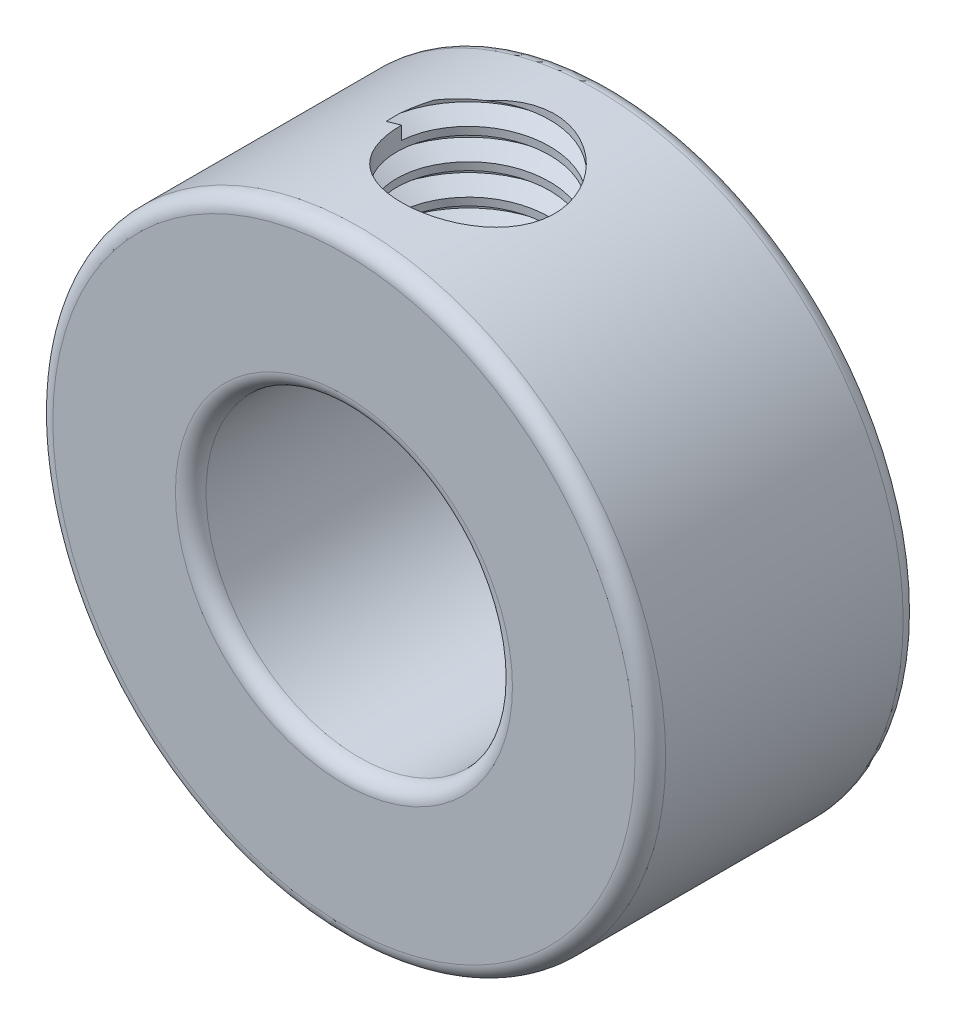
SolidWorks part; units mm, degrees
ref_plane "Front Plane" through (0, 0, 0) normal (0, 0, 1) x (1, 0, 0)
ref_plane "Top Plane" through (0, 0, 0) normal (0, 1, 0) x (1, 0, 0)
ref_plane "Right Plane" through (0, 0, 0) normal (1, 0, 0) x (0, 0, -1)
sketch "Sketch1" plane through (0, 0, 0) normal (0, 0, 1) x (1, 0, 0)
  circle A0 centre (0, 0) radius 12.7
  dimension "D2" = 25.4
extrude "Boss-Extrude1" add sketch "Sketch1" along normal blind 11.1125
ref_plane "Plane1" through (0, 12.7, 0) normal (0, 1, 0) x (1, 0, 0)
fillet "Fillet1" radius 0.635 2 edges at (12.7, 0, 0) (12.7, 0, 11.1125)
sketch "Sketch2" plane through (0, 12.7, 0) normal (0, 1, 0) x (1, 0, 0)
  line L0 (0, 0) -> (0, -5.5562) construction
  line L1 (0, -5.5562) -> (0, -11.1125) construction
  line L2 (-12.065, -11.1125) -> (12.065, -11.1125) construction
  circle A0 centre (0, -5.5562) radius 3.175
  dimension "D1" = 6.35
extrude "Cut-Extrude1" cut sketch "Sketch2" against normal blind 12.7
thread "Thread1" pitch 1.27 start angle 0, offset 0, length 12.7, pitch 1.27, diameter 6.35
ref_plane "Plane2" through (-3.175, 12.7, 5.5562) normal (0, 0, 1) x (-1, 0, 0)
sketch "Thread Profile1" plane through (-3.175, 12.7, 5.5562) normal (0, 0, 1) x (-1, 0, 0)
  line L0 (0, 0) -> (0, 1.27) construction
  line L1 (0, 0) -> (0.6874, 0.3969)
  line L2 (0.6874, 0.3969) -> (0.6874, 0.5556)
  line L3 (0.6874, 0.5556) -> (0, 0.9525)
  line L4 (0.6874, 0.4762) -> (0, 0.4762) construction
  line L11 (0, 0) -> (0, 0.9525)
  point P2 (0, 0)
  dimension "Pitch" = 1.27
  dimension "Profile_Angle" = 60
  dimension "Profile_Land" = 0.1588
  dimension "Profile_Height" = 0.6874
sketch "Sketch5" plane through (0, 0, 11.1125) normal (0, 0, 1) x (1, 0, 0)
  circle A0 centre (0, 0) radius 6.35
  dimension "D1" = 12.7
extrude "Cut-Extrude2" cut sketch "Sketch5" against normal through all
fillet "Fillet2" radius 0.635 2 edges at (6.35, 0, 0) (6.35, 0, 11.1125)
